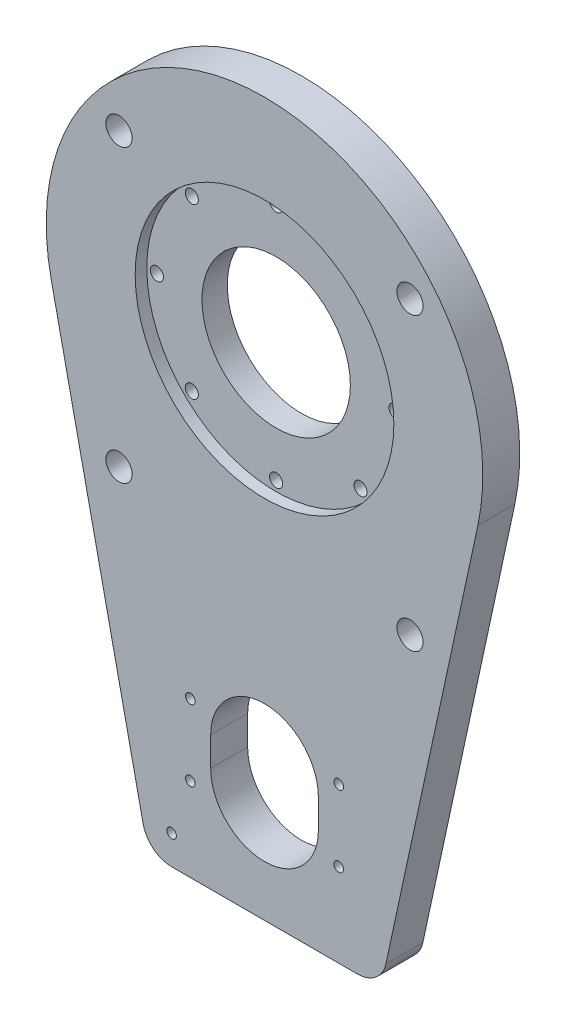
SolidWorks part; units mm, degrees
ref_plane "Front Plane" through (0, 0, 0) normal (0, 0, 1) x (1, 0, 0)
ref_plane "Top Plane" through (0, 0, 0) normal (0, 1, 0) x (1, 0, 0)
ref_plane "Right Plane" through (0, 0, 0) normal (1, 0, 0) x (0, 0, -1)
ref_plane "Plane1" through (0, 0, 12.7) normal (0, 0, 1) x (1, 0, 0)
sketch "Sketch1" plane through (0, 0, 12.7) normal (0, 0, 1) x (1, 0, 0)
  line L0 (40, -170) -> (73.3084, -15.8392)
  line L1 (-73.3084, -15.8392) -> (-40, -170)
  line L2 (-40, -170) -> (40, -170)
  arc A0 (73.3084, -15.8392) -> (-73.3084, -15.8392) centre (0, 0) ccw
extrude "Boss-Extrude1" add sketch "Sketch1" against normal blind 12.7
sketch "Sketch2" plane through (0, 0, 0) normal (0, 0, -1) x (-1, 0, 0)
  line L0 (-18.5, -124) -> (-18.5, -134)
  line L1 (18.5, -134) -> (18.5, -124)
  arc A0 (-18.5, -134) -> (18.5, -134) centre (0, -134) ccw
  arc A1 (18.5, -124) -> (-18.5, -124) centre (0, -124) ccw
extrude "Cut-Extrude1" cut sketch "Sketch2" against normal through all
hole_wizard "Hole1" positions "Sketch4" profile "Sketch3" legacy
sketch "Sketch4" plane through (0, 0, 0) normal (0, 0, -1) x (-1, 0, 0)
  point P0 (-50, -60)
  point P1 (50, -60)
  point P2 (50, 40)
  point P3 (-50, 40)
sketch "Sketch3" plane through (50, -60, 0) normal (1, 0, 0) x (0, 1, 0)
  line L0 (0, 0) -> (0, 12.7)
  line L1 (0, 12.7) -> (4.5, 12.7)
  line L2 (4.5, 12.7) -> (4.5, 0)
  line L3 (4.5, 0) -> (0, 0)
  line L4 (0, 110) -> (0, -10) construction
  dimension "Diameter" = 9
  dimension "Depth" = 12.7
hole_wizard "#4 Clearance Hole1" positions "Sketch6" profile "Sketch5" hole size "#4" standard "ANSI Inch"
sketch "Sketch6" plane through (0, 0, 12.7) normal (0, 0, 1) x (1, 0, 0)
  point P0 (-31.9299, -160)
  point P1 (-25.5, -116.75)
  point P2 (-25.5, -141.25)
  point P3 (25.5, -116.75)
  point P4 (25.5, -141.25)
sketch "Sketch5" plane through (-31.9299, -160, 12.7) normal (1, 0, 0) x (0, -1, 0)
  line L0 (0, 0) -> (0, 12.7)
  line L1 (0, 12.7) -> (1.65, 12.7)
  line L2 (1.65, 12.7) -> (1.65, 0)
  line L5 (1.65, 0) -> (0, 0)
  line L11 (0, -6.35) -> (0, 107.95) construction
  dimension "Thru Hole Dia." = 3.3
  dimension "Thru Hole Depth" = 12.7
hole_wizard "Hole2" positions "Sketch8" profile "Sketch7" legacy
sketch "Sketch8" plane through (0, 0, 12.7) normal (0, 0, 1) x (1, 0, 0)
  point P0 (0, 0)
sketch "Sketch7" plane through (0, 0, 12.7) normal (1, 0, 0) x (0, -1, 0)
  line L0 (0, 0) -> (0, 12.7)
  line L1 (0, 12.7) -> (25.5, 12.7)
  line L2 (25.5, 12.7) -> (25.5, 4)
  line L3 (25.5, 4) -> (44.45, 4)
  line L4 (44.45, 4) -> (44.45, 0)
  line L5 (44.45, 0) -> (0, 0)
  line L6 (0, 110) -> (0, -10) construction
  dimension "Diameter" = 51
  dimension "Depth" = 12.7
  dimension "C-Bore Diameter" = 88.9
  dimension "C-Bore Depth" = 4
hole_wizard "CBORE for #8 Binding Head Machine Screw1" positions "Sketch10" profile "Sketch9" counterbore size "#8" standard "ANSI Inch"
sketch "Sketch10" plane through (0, 0, 0) normal (0, 0, -1) x (-1, 0, 0)
  point P0 (28.9914, 28.9914)
  point P1 (41, 0)
  point P2 (28.9914, -28.9914)
  point P3 (0, -41)
  point P4 (-28.9914, -28.9914)
  point P5 (-41, 0)
  point P6 (-28.9914, 28.9914)
  point P7 (0, 41)
sketch "Sketch9" plane through (-28.9914, 28.9914, 0) normal (1, 0, 0) x (0, 1, 0)
  line L0 (0, 0) -> (0, 12.7)
  line L1 (0, 12.7) -> (2.25, 12.7)
  line L3 (2.25, 12.7) -> (2.25, 4)
  line L4 (2.25, 4) -> (4.125, 4)
  line L5 (4.125, 4) -> (4.125, 0)
  line L7 (4.125, 0) -> (0, 0)
  line L11 (0, -6.35) -> (0, 107.95) construction
  dimension "Thru Hole Dia." = 4.5
  dimension "Thru Hole Depth" = 12.7
  dimension "C'Bore Dia." = 8.25
  dimension "C'Bore Depth" = 4
fillet "Fillet1" radius 10 2 edges at (-40, -170, 6.35) (40, -170, 6.35)
